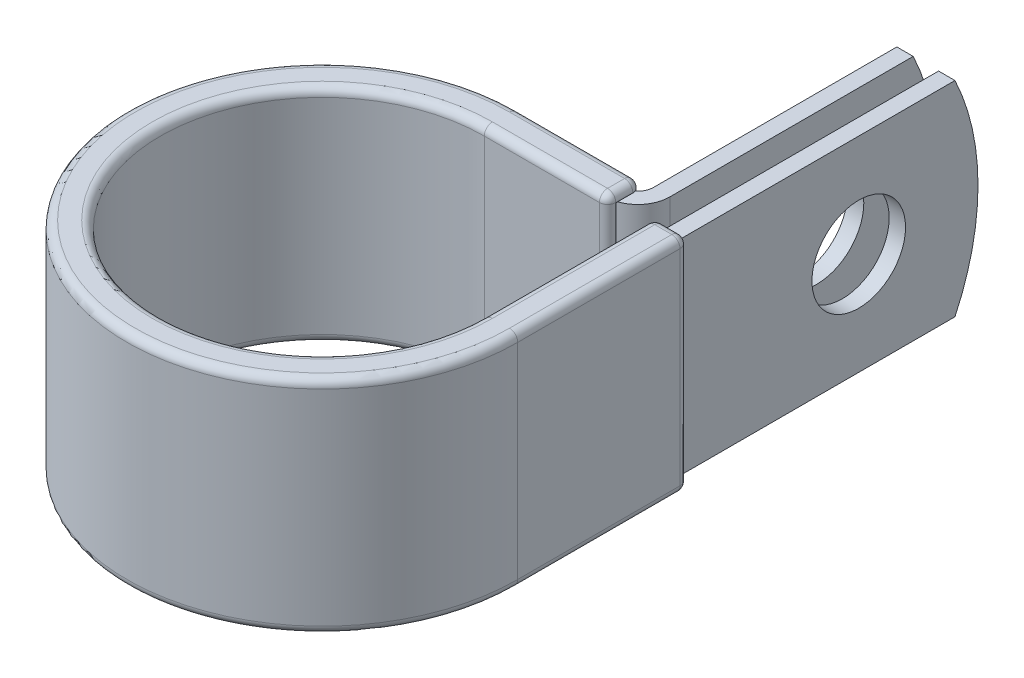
SolidWorks part; units mm, degrees
ref_plane "Front Plane" through (0, 0, 0) normal (0, 0, 1) x (1, 0, 0)
ref_plane "Top Plane" through (0, 0, 0) normal (0, 1, 0) x (1, 0, 0)
ref_plane "Right Plane" through (0, 0, 0) normal (1, 0, 0) x (0, 0, -1)
sketch "Sketch1" plane through (0, 0, 0) normal (0, 1, 0) x (1, 0, 0)
  line L0 (0, 15.8687) -> (10.5347, 15.8687)
  line L1 (15.8687, 0) -> (15.8687, 15.8687)
  line L2 (13.5064, 43.6372) -> (13.5065, 18.8405)
  line L5 (15.8687, 15.8687) -> (15.8687, 43.6372)
  arc A0 (0, 15.8687) -> (15.8687, 0) centre (0, 0) ccw
  arc A3 (10.5347, 15.8687) -> (13.5065, 18.8405) centre (10.5347, 18.8405) ccw
extrude "Extrude-Thin1" add sketch "Sketch1" along normal mid plane 19.05 thin
sketch "Sketch2" plane through (11.9825, 0, 0) normal (-1, 0, 0) x (0, 0, 1)
  line L0 (-43.6372, 9.525) -> (-43.6372, -9.525) construction
  line L7 (0, 9.525) -> (0, -9.525) construction
  circle A0 centre (-32.5374, 0) radius 4.3561
  point P2 (-43.6372, 0)
extrude "Cut-Extrude1" cut sketch "Sketch2" against normal up to surface (1.524 mm away)
sketch "Sketch3" plane through (17.3927, 0, 0) normal (1, 0, 0) x (0, 0, -1)
  line L0 (43.6372, 9.525) -> (43.6372, -9.525) construction
  circle A0 centre (32.5374, 0) radius 4.3561
  point P3 (43.6372, 0)
extrude "Cut-Extrude2" cut sketch "Sketch3" against normal up to surface (1.524 mm away)
sketch "Sketch4" plane through (11.9825, 0, 0) normal (-1, 0, 0) x (0, 0, 1)
  line L0 (-43.6372, 9.525) -> (-43.6372, -9.525)
  line L1 (-43.6372, 9.525) -> (-41.4927, 9.525)
  line L2 (-43.6372, 9.525) -> (-18.8405, 9.525) construction
  line L3 (-43.6372, -9.525) -> (-41.4927, -9.525)
  line L4 (-43.6372, -9.525) -> (-18.8405, -9.525) construction
  arc A0 (-41.4927, 9.525) -> (-41.4927, -9.525) centre (-21.4122, 0) ccw
extrude "Cut-Extrude3" cut sketch "Sketch4" against normal through all contours A0 M4 M5 | A0 L0 M2
ref_plane "Plane1" through (0, 0, -15.8687) normal (0, 0, 1) x (1, 0, 0)
ref_plane "Plane2" through (0, 0, 0) normal (-1, 0, 0) x (0, 0, 1)
sketch "Sketch5" plane through (0, 0, -15.8687) normal (0, 0, 1) x (1, 0, 0)
  line L0 (15.8687, 9.525) -> (17.3927, 9.525)
  line L1 (15.8687, -9.525) -> (15.8687, 9.525)
  line L2 (15.0749, -9.5568) -> (15.0749, 9.5567)
  line L3 (17.3927, 9.525) -> (17.3927, -9.525)
  line L4 (17.3927, -9.525) -> (15.8687, -9.525)
  line L5 (15.8369, 10.3187) -> (17.4244, 10.3188)
  line L7 (18.1864, 9.5567) -> (18.1864, -9.5568)
  line L8 (17.4244, -10.3188) -> (15.8369, -10.3188)
  line L9 (15.0749, -10.3188) -> (15.0749, 10.3187) construction
  line L11 (18.1864, -10.3188) -> (15.0749, -10.3188) construction
  line L12 (18.1864, 10.3187) -> (18.1864, -10.3188) construction
  line L13 (15.0749, 10.3187) -> (18.1864, 10.3187) construction
  arc A0 (15.0749, -9.5568) -> (15.8369, -10.3188) centre (15.8369, -9.5568) ccw
  arc A1 (18.1864, -9.5568) -> (17.4244, -10.3188) centre (17.4244, -9.5568) cw
  arc A2 (17.4244, 10.3188) -> (18.1864, 9.5567) centre (17.4244, 9.5567) cw
  arc A3 (15.0749, 9.5567) -> (15.8369, 10.3187) centre (15.8369, 9.5567) cw
sketch "Sketch6" plane through (0, 9.525, 0) normal (0, 1, 0) x (1, 0, 0)
  line L0 (15.0749, 0) -> (15.0749, 15.8687)
  line L1 (0, 15.0749) -> (11.4745, 15.0749)
  line L2 (11.9825, 41.4927) -> (11.9825, 18.8405) construction
  arc A0 (0, 15.0749) -> (15.0749, 0) centre (0, 0) ccw
sweep "Sweep1" add profiles "Sketch5" path "Sketch6"
fillet "Fillet1" radius 0.762 16 edges at (11.4745, 10.0956, -17.9632) (11.4745, 0, -18.1864) (11.4745, -10.0956, -17.9632) (11.4745, -10.3188, -16.6307) (11.4745, -10.0956, -15.2981) (11.4745, 0, -15.0749) (11.4745, 10.0956, -15.2981) (17.9632, 10.0956, -15.8687) (18.1864, 0, -15.8687) (17.9632, -10.0956, -15.8687) (16.6307, -10.3188, -15.8687) (15.2981, -10.0956, -15.8687) (15.0749, 0, -15.8687) (15.2981, 10.0956, -15.8687) (11.4745, 10.3188, -16.6307) (16.6307, 10.3188, -15.8687)
equation "\"D4@Sketch5\"=\"D1@Extrude-Thin1\""
equation "\"D5@Sketch5\"=\"D5@Extrude-Thin1\""
equation "\"D1@Sketch3\"=\"D2@Sketch2\""
equation "\"D7@Sketch1\"=\"D3@Sketch2\" + \"D1@Sketch3\""
equation "\"D1@Sketch1\"=\"D1@Sketch6\" + 2 * \"D3@Sketch5\""
equation "\"D1@Sketch4\"=( \"D1@Extrude-Thin1\" + .125 ) * 2"
equation "\"D2@Sketch1\"=1.95*\"D5@Extrude-Thin1\""
equation "\"D2@Sketch3\"=\"D1@Sketch2\""
